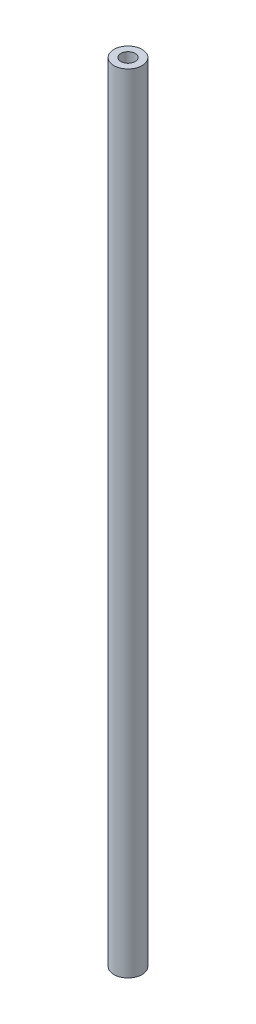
SolidWorks part; units mm, degrees
ref_plane "Front Plane" through (0, 0, 0) normal (0, 0, 1) x (1, 0, 0)
ref_plane "Top Plane" through (0, 0, 0) normal (0, 1, 0) x (1, 0, 0)
ref_plane "Right Plane" through (0, 0, 0) normal (1, 0, 0) x (0, 0, -1)
sketch "Sketch1" plane through (0, 0, 0) normal (0, 1, 0) x (1, 0, 0)
  circle A0 centre (0, 0) radius 4.7625
  circle A1 centre (0, 0) radius 1.8415
  dimension "D1" = 2.921
  dimension "D2" = 9.525
extrude "Boss-Extrude1" add sketch "Sketch1" along normal blind 266.7
hole_wizard "#10-32 Tapped Hole1" positions "Sketch3" profile "Sketch2" tap size "#10-32" standard "ANSI Inch"
sketch "Sketch3" plane through (0, 0, 0) normal (0, -1, 0) x (-1, 0, 0)
  point P0 (0, 0)
sketch "Sketch2" plane through (0, 0, 0) normal (1, 0, 0) x (0, 0, -1)
  line L0 (0, 0) -> (0, 32.9633)
  line L1 (0, 32.9633) -> (2.0193, 31.75)
  line L2 (2.0193, 31.75) -> (2.0193, 25.4)
  line L3 (2.0193, 25.4) -> (2.413, 25.4)
  line L4 (2.413, 25.4) -> (2.413, 0)
  line L5 (2.413, 0) -> (0, 0)
  line L10 (0, 32.9633) -> (-2.0193, 31.75) construction
  line L11 (0, -6.35) -> (0, 107.95) construction
  dimension "Tap Drill Dia." = 4.0386
  dimension "Tap Drill Depth" = 31.75
  dimension "Thread Major Dia." = 4.826
  dimension "Thread Depth" = 25.4
  dimension "Drill Angle" = 118
hole_wizard "#10-32 Tapped Hole2" positions "Sketch5" profile "Sketch4" tap size "#10-32" standard "ANSI Inch"
sketch "Sketch5" plane through (0, 266.7, 0) normal (0, 1, 0) x (1, 0, 0)
  point P0 (0, 0)
sketch "Sketch4" plane through (0, 266.7, 0) normal (1, 0, 0) x (0, 0, 1)
  line L0 (0, 0) -> (0, 32.9633)
  line L1 (0, 32.9633) -> (2.0193, 31.75)
  line L2 (2.0193, 31.75) -> (2.0193, 25.4)
  line L3 (2.0193, 25.4) -> (2.413, 25.4)
  line L4 (2.413, 25.4) -> (2.413, 0)
  line L5 (2.413, 0) -> (0, 0)
  line L10 (0, 32.9633) -> (-2.0193, 31.75) construction
  line L11 (0, -6.35) -> (0, 107.95) construction
  dimension "Tap Drill Dia." = 4.0386
  dimension "Tap Drill Depth" = 31.75
  dimension "Thread Major Dia." = 4.826
  dimension "Thread Depth" = 25.4
  dimension "Drill Angle" = 118
